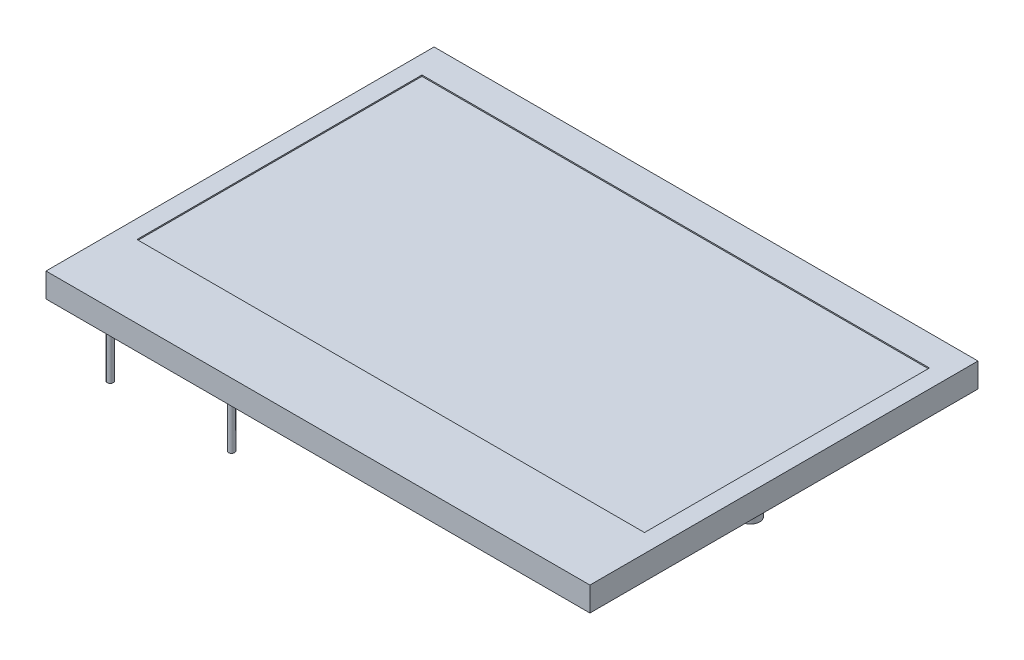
SolidWorks part; units mm, degrees
ref_plane "Front" through (0, 0, 0) normal (0, 0, 1) x (1, 0, 0)
ref_plane "Top" through (0, 0, 0) normal (0, 1, 0) x (1, 0, 0)
ref_plane "Right" through (0, 0, 0) normal (1, 0, 0) x (0, 0, -1)
sketch "Эскиз1" plane through (0, 0, 0) normal (0, 1, 0) x (1, 0, 0)
  line L1 (-22.425, -17.5) -> (22.425, -17.5)
  line L2 (-22.425, -17.5) -> (-22.425, 14.5)
  line L3 (-22.425, 14.5) -> (22.425, 14.5)
  line L4 (22.425, -17.5) -> (22.425, 14.5)
  line L5 (-22.425, -17.5) -> (22.425, 14.5) construction
  line L6 (-22.425, 14.5) -> (22.425, -17.5) construction
  point P0 (0, -1.5)
  dimension "D1" = 44.85
  dimension "D2" = 32
  dimension "D3" = 14.5
extrude "Вытянуть1" add sketch "Эскиз1" along normal blind 2 from offset 2.5
sketch "Эскиз2" plane through (0, 4.5, 0) normal (0, 1, 0) x (1, 0, 0)
  line L0 (0, 14.5) -> (0, 0) construction
  line L1 (-20.925, 12) -> (20.925, 12)
  line L2 (-20.925, 12) -> (-20.925, -11.5)
  line L3 (-20.925, -11.5) -> (20.925, -11.5)
  line L4 (20.925, 12) -> (20.925, -11.5)
  line L5 (22.425, 14.5) -> (-22.425, 14.5) construction
  dimension "D1" = 41.85
  dimension "D2" = 23.5
  dimension "D3" = 2.5
extrude "Вытянуть2" cut sketch "Эскиз2" against normal blind 0.1
sketch "Эскиз3" plane through (0, 2.5, 0) normal (0, -1, 0) x (1, 0, 0)
  line L0 (0, 0) -> (0, -14.5) construction
  line L1 (22.425, -14.5) -> (-22.425, -14.5) construction
  circle A0 centre (-18.17, 0) radius 1.5
  circle A1 centre (18.17, 0) radius 1.5
  dimension "D1" = 3
  dimension "D2" = 36.34
extrude "Вытянуть3" add sketch "Эскиз3" along normal blind 2.5
sketch "Эскиз4" plane through (0, 0, 0) normal (0, -1, 0) x (1, 0, 0)
  circle A0 centre (-18.17, 0) radius 0.75
  circle A1 centre (18.17, 0) radius 0.75
  dimension "D1" = 1.5
extrude "Вытянуть4" add sketch "Эскиз4" along normal blind 1.5
sketch "Эскиз5" plane through (0, 2.5, 0) normal (0, -1, 0) x (1, 0, 0)
  line L0 (-22.425, -14.5) -> (-22.425, 17.5) construction
  line L1 (-22.425, 17.5) -> (22.425, 17.5) construction
  circle A0 centre (-18.425, 16.2) radius 0.25
  circle A1 centre (-8.425, 16.2) radius 0.25
  dimension "D1" = 4
  dimension "D2" = 10
  dimension "D3" = 0.5
  dimension "D4" = 1.3
extrude "Вытянуть5" add sketch "Эскиз5" along normal blind 4.5
